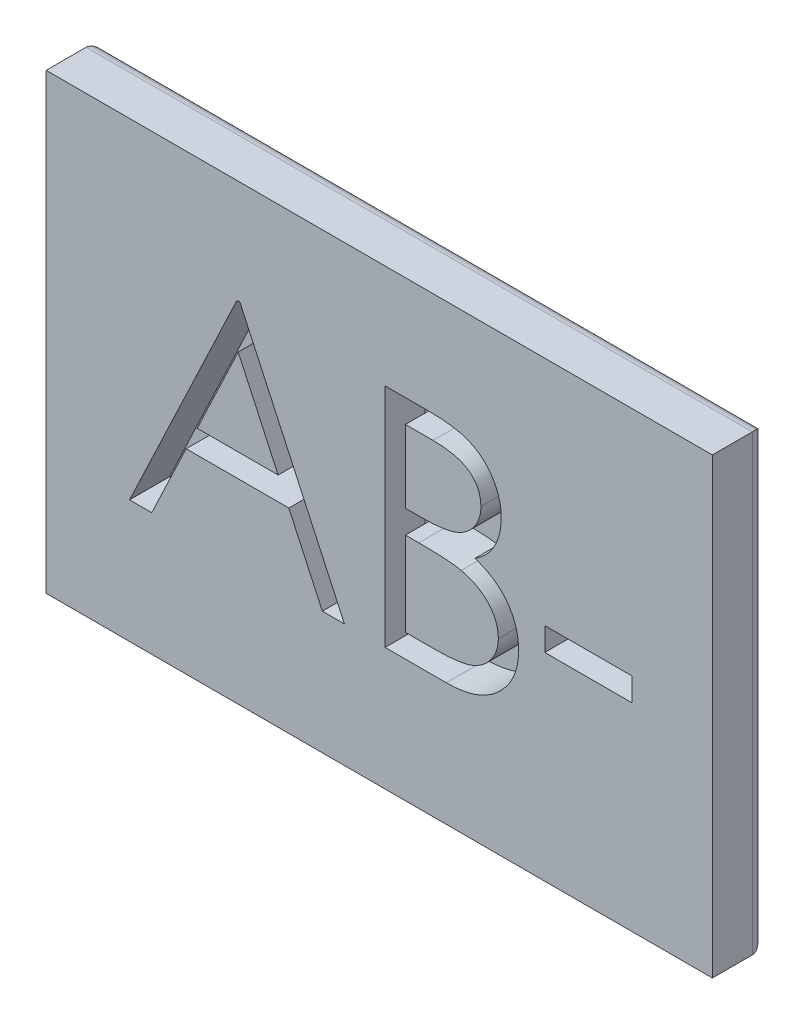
SolidWorks part; units mm, degrees
ref_plane "Front Plane" through (0, 0, 0) normal (0, 0, 1) x (1, 0, 0)
ref_plane "Top Plane" through (0, 0, 0) normal (0, 1, 0) x (1, 0, 0)
ref_plane "Right Plane" through (0, 0, 0) normal (1, 0, 0) x (0, 0, -1)
sketch "Sketch1" plane through (0, 0, 0) normal (0, 0, 1) x (1, 0, 0)
  line L1 (-15.875, -10.795) -> (15.875, -10.795)
  line L2 (-15.875, -10.795) -> (-15.875, 10.795)
  line L3 (-15.875, 10.795) -> (15.875, 10.795)
  line L4 (15.875, -10.795) -> (15.875, 10.795)
  line L5 (-15.875, -10.795) -> (15.875, 10.795) construction
  line L6 (-15.875, 10.795) -> (15.875, -10.795) construction
  point P0 (0, 0)
  dimension "D1" = 31.75
  dimension "D2" = 21.59
extrude "Boss-Extrude1" add sketch "Sketch1" along normal blind 2.54
fillet "Fillet1" radius 0.635 4 edges at (-15.875, 0, 0) (0, -10.795, 0) (0, 10.795, 0) (15.875, 0, 0)
sketch "Sketch2" plane through (0, 0, 2.54) normal (0, 0, 1) x (1, 0, 0)
  line L0 (-15.875, 10.795) -> (-14.977, 9.897) construction
  line L2 (-14.977, 9.897) -> (-14.977, 4.9485) construction
  line L3 (-14.977, 4.9485) -> (-14.977, 0) construction
  line L4 (-14.977, 0) -> (-14.977, -4.9485) construction
  line L5 (-14.977, -4.9485) -> (-14.977, -9.897) construction
  line L6 (-14.977, -9.897) -> (-15.875, -10.795) construction
  line L7 (15.875, 10.795) -> (-15.875, 10.795) construction
  line L8 (-15.875, -10.795) -> (15.875, -10.795) construction
  line L9 (-14.977, 4.9485) -> (14.977, 4.9485) construction
  line L10 (14.977, 4.9485) -> (14.977, 0) construction
  line L11 (14.977, 0) -> (-14.977, 0) construction
  line L12 (14.977, 0) -> (14.977, -4.9485) construction
  line L13 (14.977, -4.9485) -> (-14.977, -4.9485) construction
  line L14 (-14.977, -9.897) -> (14.977, -9.897) construction
  line L15 (14.977, -9.897) -> (14.977, -4.9485) construction
  line L16 (-14.977, 9.897) -> (14.977, 9.897) construction
  line L17 (14.977, 9.897) -> (14.977, 4.9485) construction
  line L18 (14.977, 9.897) -> (15.875, 10.795) construction
  line L19 (14.977, -9.897) -> (15.875, -10.795) construction
  text T0 "AB-" font "Century Gothic" height 10.795
  dimension "D1" = 45
  dimension "D2" = 45
  dimension "D3" = 1.27
extrude "Cut-Extrude1" cut sketch "Sketch2" against normal blind 1.905
